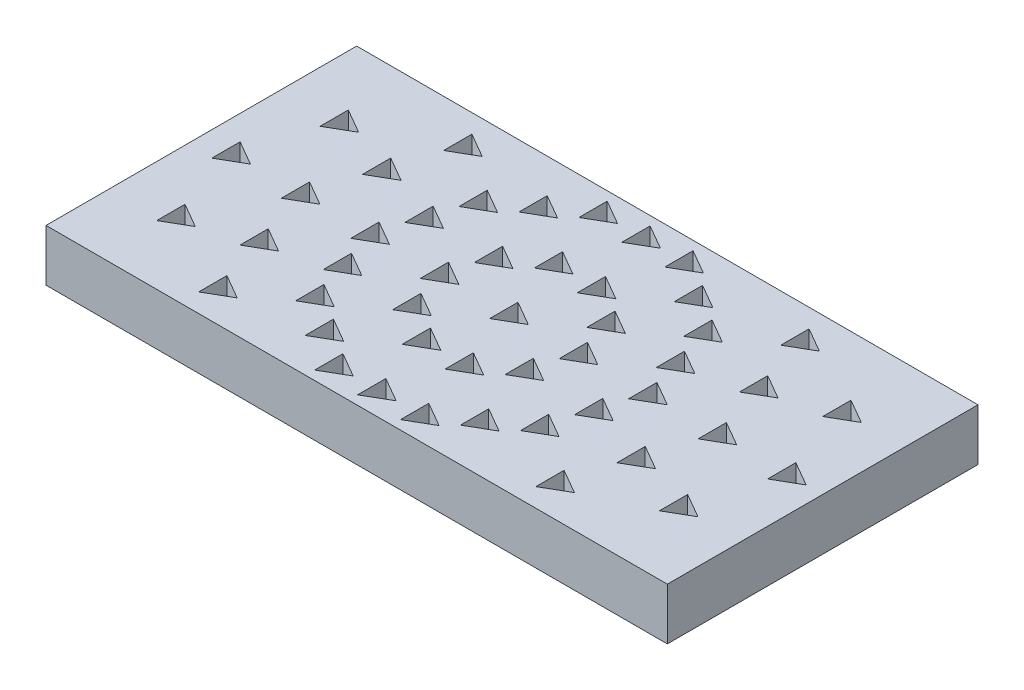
SolidWorks part; units mm, degrees
ref_plane "Front Plane" through (0, 0, 0) normal (0, 0, 1) x (1, 0, 0)
ref_plane "Top Plane" through (0, 0, 0) normal (0, 1, 0) x (1, 0, 0)
ref_plane "Right Plane" through (0, 0, 0) normal (1, 0, 0) x (0, 0, -1)
sketch "Sketch1" plane through (0, 0, 0) normal (0, 1, 0) x (1, 0, 0)
  line L1 (-76.2, 38.1) -> (76.2, 38.1)
  line L2 (-76.2, 38.1) -> (-76.2, -38.1)
  line L3 (-76.2, -38.1) -> (76.2, -38.1)
  line L4 (76.2, 38.1) -> (76.2, -38.1)
  dimension "D1" = 152.4
  dimension "D2" = 76.2
  dimension "D3" = 76.2
  dimension "D4" = 38.1
extrude "Extrude1" add sketch "Sketch1" along normal blind 12.7
other "Fill Pattern3" parameters "D9"=4, "D10"=8, "D4"=17.0388, "D5"=15.24, "D3"=0
